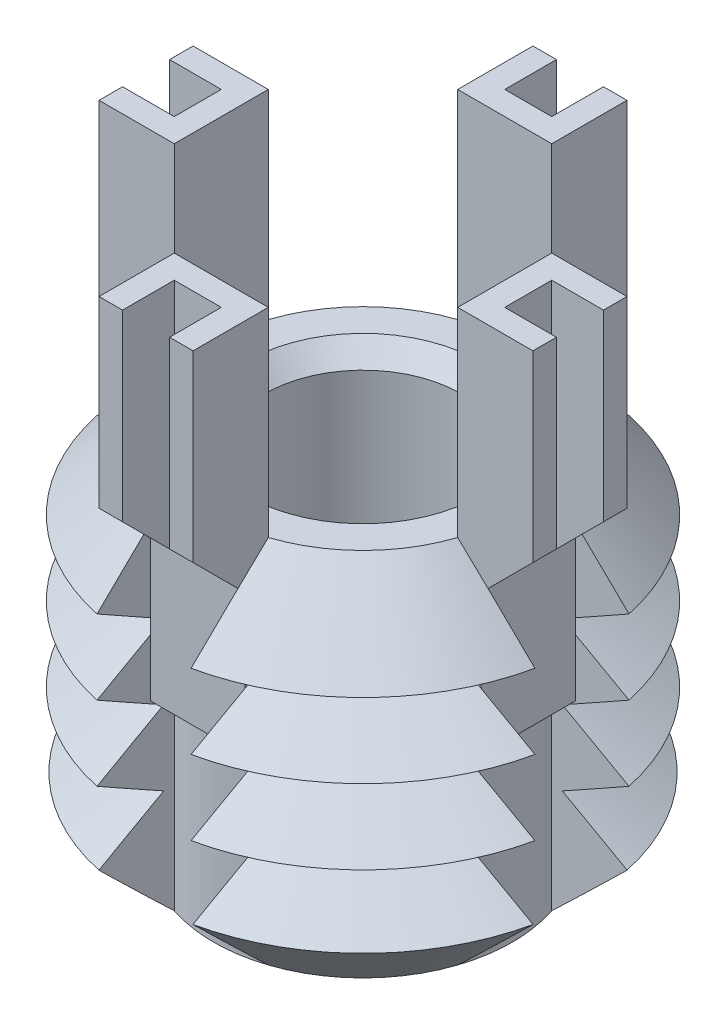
SolidWorks part; units mm, degrees
ref_plane "Front Plane" through (0, 0, 0) normal (0, 0, 1) x (1, 0, 0)
ref_plane "Top Plane" through (0, 0, 0) normal (0, 1, 0) x (1, 0, 0)
ref_plane "Right Plane" through (0, 0, 0) normal (1, 0, 0) x (0, 0, -1)
sketch "Sketch1" plane through (0, 0, 0) normal (0, 1, 0) x (1, 0, 0)
  circle A0 centre (0, 0) radius 4.7625
  dimension "D1" = 9.525
extrude "Boss-Extrude1" add sketch "Sketch1" against normal blind 7.874
chamfer "Chamfer1" distance 1.587 angle 45 2 edges at (0, -7.874, 4.7625) (0, 0, 4.7625)
sketch "Sketch2" plane through (0, 0, 0) normal (1, 0, 0) x (0, 0, -1)
  line L0 (0, 0.8859) -> (0, -9.2617) construction
sketch "Sketch3" plane through (0, 0, 0) normal (1, 0, 0) x (0, 0, -1)
  line L0 (-4.7625, -1.587) -> (-3.3881, -2.3805)
  line L1 (-3.3881, -2.3805) -> (-4.7625, -3.174)
  line L2 (-4.7625, -1.587) -> (-4.7625, -6.287) construction
  line L3 (-4.7625, -3.174) -> (-4.7625, -1.587)
  dimension "D1" = 1.587
revolve "Cut-Revolve1" cut sketch "Sketch3" angle 360 about L0
pattern_linear "LPattern1" count 3 spacing 1.587 along (0, -1, 0) of "Cut-Revolve1"
sketch "Sketch4" plane through (0, 0, 0) normal (0, 1, 0) x (1, 0, 0)
  line L0 (-3.0139, 1) -> (-4.6563, 1)
  line L2 (-4.6563, -1) -> (-3.0139, -1)
  arc A0 (-3.0139, 1) -> (-3.0139, -1) centre (0, 0) ccw
  arc A1 (-4.6563, 1) -> (-4.6563, -1) centre (0, 0) ccw
  circle A2 centre (0, 0) radius 4.7625 construction
  circle A3 centre (0, 0) radius 3.1755 construction
  point P1 (-3.1755, 0)
  point P3 (-4.7625, 0)
  point P13 (0, 0)
  dimension "D1" = 2
extrude "Cut-Extrude1" cut sketch "Sketch4" against normal up to surface (7.874 mm away)
pattern_circular "CirPattern1" count 4 over 360 about axis through (0, 0, 0) along (0, 1, 0) of "Cut-Extrude1"
sketch "Sketch5" plane through (0, 0, 0) normal (1, 0, 0) x (0, 0, -1)
  line L0 (-3.0139, 4.239) -> (-3.0139, -3.761)
  line L1 (-3.0139, -3.761) -> (-3.5139, -3.761)
  line L2 (-3.5139, -3.761) -> (-3.5139, -0.761)
  line L3 (-3.5139, -0.761) -> (-4.6139, 0.339)
  line L4 (-4.6139, 0.339) -> (-4.6139, 4.239)
  line L5 (-4.6139, 4.239) -> (-3.0139, 4.239)
  line L6 (-4.6563, -4.761) -> (-1, -4.761) construction
  point P9 (-1, 0)
  point P10 (-3.5139, -0.761)
  dimension "D1" = 1
  dimension "D2" = 8
  dimension "D3" = 5
  dimension "D4" = 1.6
  dimension "D5" = 0.5
  dimension "D6" = 45
extrude "Boss-Extrude3" add sketch "Sketch5" along normal mid plane 2
pattern_circular "CirPattern2" count 4 over 360 about axis through (0, 0, 0) along (0, 1, 0) of "Boss-Extrude3"
sketch "Sketch6" plane through (0, 4.239, 0) normal (0, 1, 0) x (1, 0, 0)
  line L0 (-4.6139, -1) -> (-4.6139, 1) construction
  line L1 (-4.6139, -0.5) -> (-3.5139, -0.5)
  line L2 (-4.6139, -0.5) -> (-4.6139, 0.5)
  line L3 (-4.6139, 0.5) -> (-3.5139, 0.5)
  line L4 (-3.5139, -0.5) -> (-3.5139, 0.5)
  line L5 (-4.6139, -0.5) -> (-3.5139, 0.5) construction
  line L6 (-4.6139, 0.5) -> (-3.5139, -0.5) construction
  line L7 (4.6139, 1) -> (4.6139, -1) construction
  line L8 (-0.5, 3.5139) -> (0.5, 3.5139)
  line L9 (-0.5, 3.5139) -> (-0.5, 4.6139)
  line L10 (-0.5, 4.6139) -> (0.5, 4.6139)
  line L11 (0.5, 3.5139) -> (0.5, 4.6139)
  line L12 (-0.5, 3.5139) -> (0.5, 4.6139) construction
  line L13 (-0.5, 4.6139) -> (0.5, 3.5139) construction
  line L14 (3.5139, -0.5) -> (4.6139, -0.5)
  line L15 (3.5139, -0.5) -> (3.5139, 0.5)
  line L16 (3.5139, 0.5) -> (4.6139, 0.5)
  line L17 (4.6139, -0.5) -> (4.6139, 0.5)
  line L18 (3.5139, -0.5) -> (4.6139, 0.5) construction
  line L19 (3.5139, 0.5) -> (4.6139, -0.5) construction
  line L20 (-0.5, -4.6139) -> (0.5, -4.6139)
  line L21 (-0.5, -4.6139) -> (-0.5, -3.5139)
  line L22 (-0.5, -3.5139) -> (0.5, -3.5139)
  line L23 (0.5, -4.6139) -> (0.5, -3.5139)
  line L24 (-0.5, -4.6139) -> (0.5, -3.5139) construction
  line L25 (-0.5, -3.5139) -> (0.5, -4.6139) construction
  line L26 (-1, 4.6139) -> (1, 4.6139) construction
  line L27 (1, -4.6139) -> (-1, -4.6139) construction
  point P0 (-4.0639, 0)
  point P7 (-4.6139, 0)
  point P8 (-4.6139, 0)
  point P9 (0, 4.0639)
  point P14 (4.0639, 0)
  point P19 (0, -4.0639)
  point P24 (0, 4.6139)
  point P25 (4.6139, 0)
  point P26 (4.6139, 0)
  point P27 (0, 4.6139)
  point P30 (0, -4.6139)
  point P33 (0, -4.6139)
  dimension "D1" = 1
  dimension "D2" = 1.1
extrude "Cut-Extrude3" cut sketch "Sketch6" against normal through all both and the other way through all
sketch "Sketch7" plane through (0, 0, 0) normal (0, 1, 0) x (1, 0, 0)
  circle A0 centre (0, 0) radius 2.083
  dimension "D1" = 4.166
extrude "Cut-Extrude4" cut sketch "Sketch7" against normal up to surface (7.874 mm away)
chamfer "Chamfer2" distance 0.397 angle 45 2 edges at (0, 0, 2.083) (0, -7.874, 2.083)
